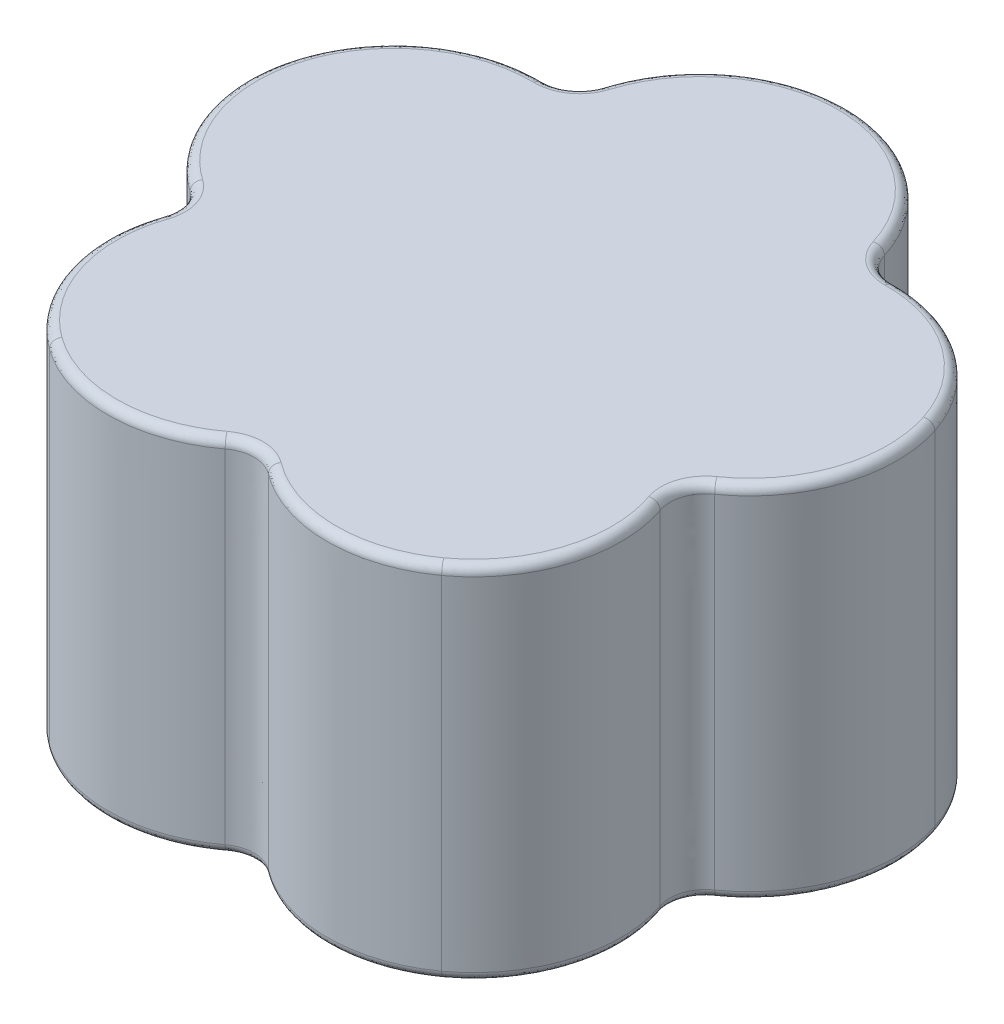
SolidWorks part; units mm, degrees
ref_plane "Front Plane" through (0, 0, 0) normal (0, 0, 1) x (1, 0, 0)
ref_plane "Top Plane" through (0, 0, 0) normal (0, 1, 0) x (1, 0, 0)
ref_plane "Right Plane" through (0, 0, 0) normal (1, 0, 0) x (0, 0, -1)
body saved out of another part "Stock-Wooden Clock Video-1"
fillet "Fillet1" radius 0.5 28 edges
